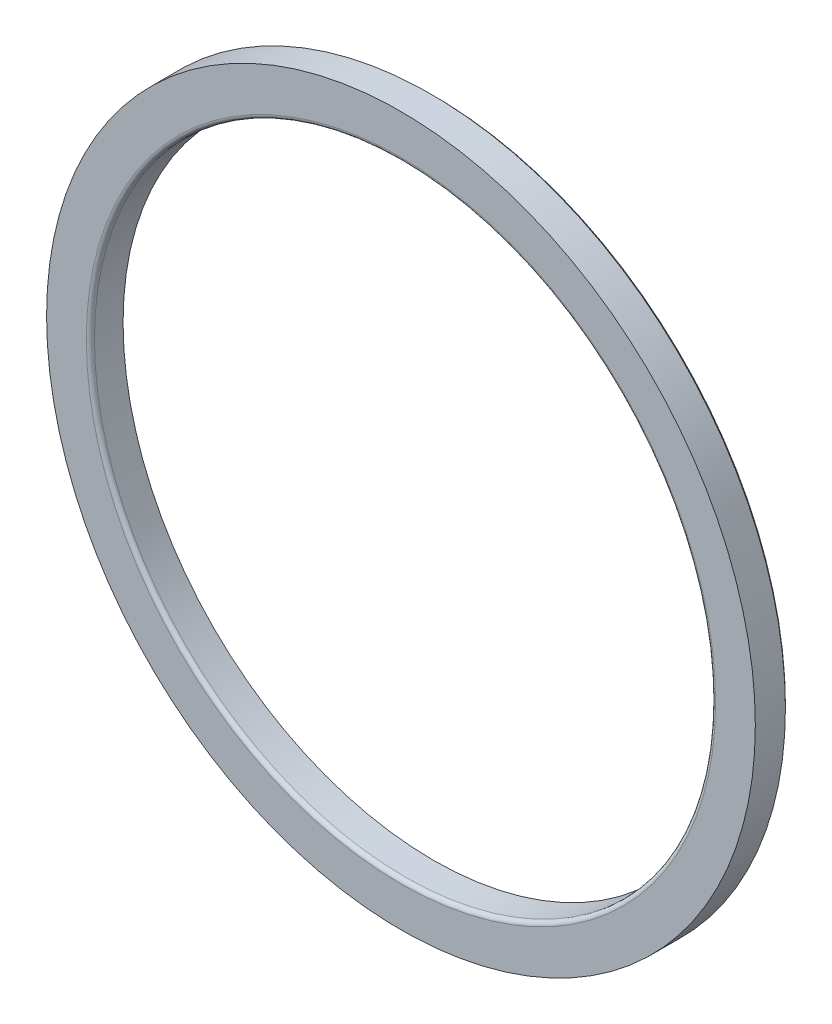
SolidWorks part; units mm, degrees
ref_plane "Front Plane" through (0, 0, 0) normal (0, 0, 1) x (1, 0, 0)
ref_plane "Top Plane" through (0, 0, 0) normal (0, 1, 0) x (1, 0, 0)
ref_plane "Right Plane" through (0, 0, 0) normal (1, 0, 0) x (0, 0, -1)
sketch "Sketch1" plane through (0, 0, 0) normal (0, 0, 1) x (1, 0, 0)
  circle A0 centre (0, 0) radius 60.325
  circle A1 centre (0, 0) radius 68.834
  dimension "D1" = 120.65
  dimension "D2" = 137.668
extrude "Boss-Extrude1" add sketch "Sketch1" along normal blind 6.35
chamfer "Chamfer1" distance 0.508 angle 45 1 edges at (68.834, 0, 0)
fillet "Fillet1" radius 0.7937 1 edges at (60.325, 0, 6.35)
equation "\"Air Weight\"= \"SW-Mass\""
equation "\"Buoyancy\"= \"SW-Volume\" * ( \"SW-Density\" - .037062 )"
